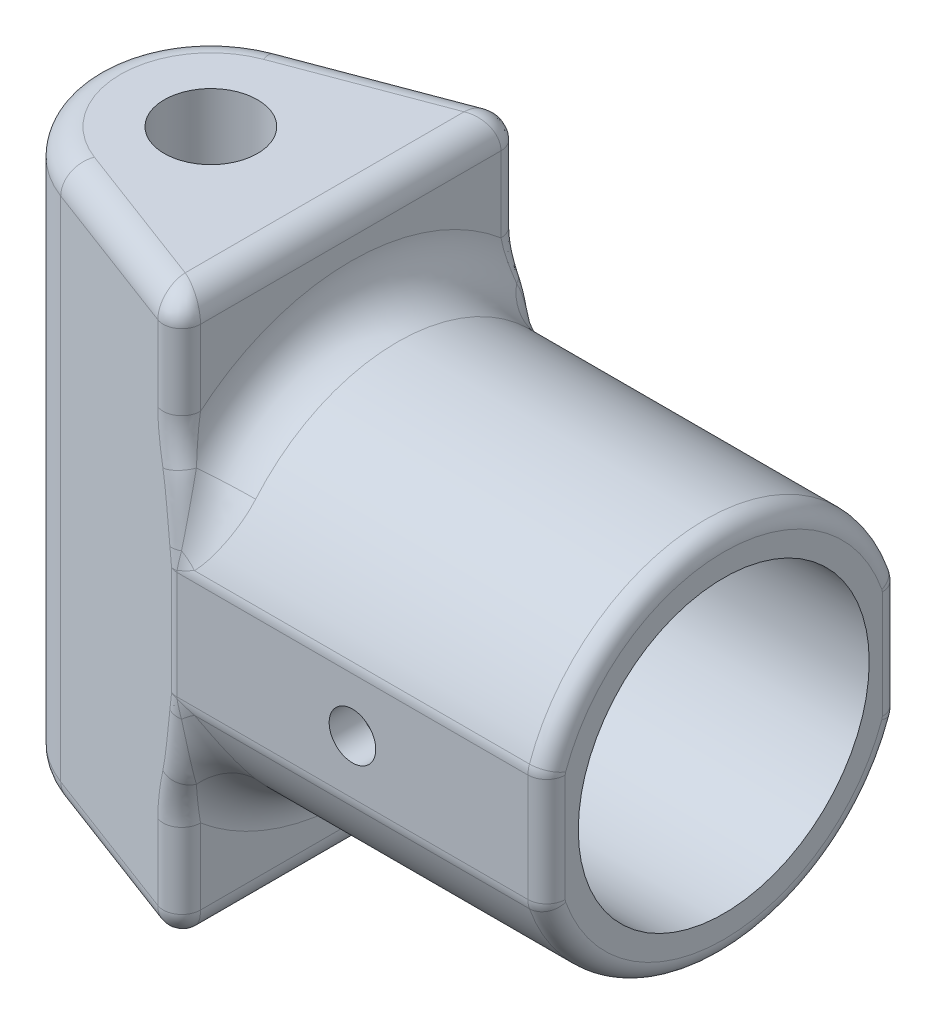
SolidWorks part; units mm, degrees
ref_plane "Front Plane" through (0, 0, 0) normal (0, 0, 1) x (1, 0, 0)
ref_plane "Top Plane" through (0, 0, 0) normal (0, 1, 0) x (1, 0, 0)
ref_plane "Right Plane" through (0, 0, 0) normal (1, 0, 0) x (0, 0, -1)
sketch "Sketch1" plane through (0, 0, 0) normal (0, 1, 0) x (1, 0, 0)
  line L0 (-1.3977, -3.7145) -> (4.7625, -6.0325)
  line L1 (-1.3977, 3.7145) -> (4.7625, 6.0325)
  line L2 (4.7625, 6.0325) -> (4.7625, -6.0325)
  arc A0 (-1.3977, 3.7145) -> (-1.3977, -3.7145) centre (0, 0) ccw
  circle A1 centre (0, 0) radius 1.5875
  point P8 (4.7625, 0)
  dimension "D1" = 3.9688
  dimension "D2" = 3.175
  dimension "D3" = 12.065
  dimension "D4" = 4.7625
extrude "Boss-Extrude1" add sketch "Sketch1" along normal blind 19.05
ref_plane "Plane1" through (3.9688, 0, 0) normal (1, 0, 0) x (0, 0, -1)
sketch "Sketch2" plane through (4.7625, 0, 0) normal (1, 0, 0) x (0, 0, -1)
  line L0 (-3.7145, 0) -> (3.7145, 0) construction
  circle A0 centre (0, 9.525) radius 6.35
  circle A1 centre (0, 9.525) radius 4.953
  dimension "D1" = 9.906
  dimension "D2" = 12.7
  dimension "D3" = 9.525
extrude "Boss-Extrude2" add sketch "Sketch2" along normal blind 12.7 separate body contours A0 A1 M5 M7
fillet "Fillet1" radius 0.889 12 edges at (-3.9688, 0, 0) (-3.9688, 19.05, 0) (1.6824, 0, -4.8735) (1.6824, 0, 4.8735) (1.6824, 19.05, -4.8735) (1.6824, 19.05, 4.8735) (4.7625, 0, 0) (4.7625, 19.05, 0)
fillet "Fillet2" radius 1.5875 6 edges at (4.7625, 7.5385, 6.0195) (4.7625, 7.5385, -6.0195) (4.7625, 11.5115, -6.0195) (4.7625, 11.5115, 6.0195)
fillet "Fillet3" radius 0.635 26 edges at (4.5021, 18.7896, -5.6563) (4.5021, 0.2604, -5.6563) (4.5021, 18.7896, 5.6563) (4.5021, 0.2604, 5.6563) (17.4625, 11.5115, -6.0195) (17.4625, 9.525, -6.0325) (17.4625, 7.5385, -6.0195) (17.4625, 3.175, 0) (17.4625, 7.5385, 6.0195) (17.4625, 9.525, 6.0325) (17.4625, 11.5115, 6.0195) (17.4625, 15.875, 0)
hole_wizard "1/16 (0.0625) Diameter Hole1" positions "Sketch4" profile "Sketch3" hole size "1/16" standard "ANSI Inch"
sketch "Sketch4" plane through (0, 0, -6.0325) normal (0, 0, -1) x (-1, 0, 0)
  line L0 (-16.8275, 11.3599) -> (-16.8275, 7.6901) construction
  line L1 (-4.878, 11.3599) -> (-16.8275, 11.3599) construction
  point P0 (-10.8528, 9.525)
  point P5 (-16.8275, 9.525)
  point P8 (-10.8528, 11.3599)
sketch "Sketch3" plane through (10.8528, 9.525, -6.0325) normal (1, 0, 0) x (0, 1, 0)
  line L0 (0, 0) -> (0, 12.2443)
  line L1 (0, 12.2443) -> (0.7937, 12.2443)
  line L2 (0.7937, 12.2443) -> (0.7937, 0)
  line L5 (0.7937, 0) -> (0, 0)
  line L11 (0, -6.35) -> (0, 107.95) construction
  dimension "Thru Hole Dia." = 1.5875
  dimension "Thru Hole Depth" = 12.2443
